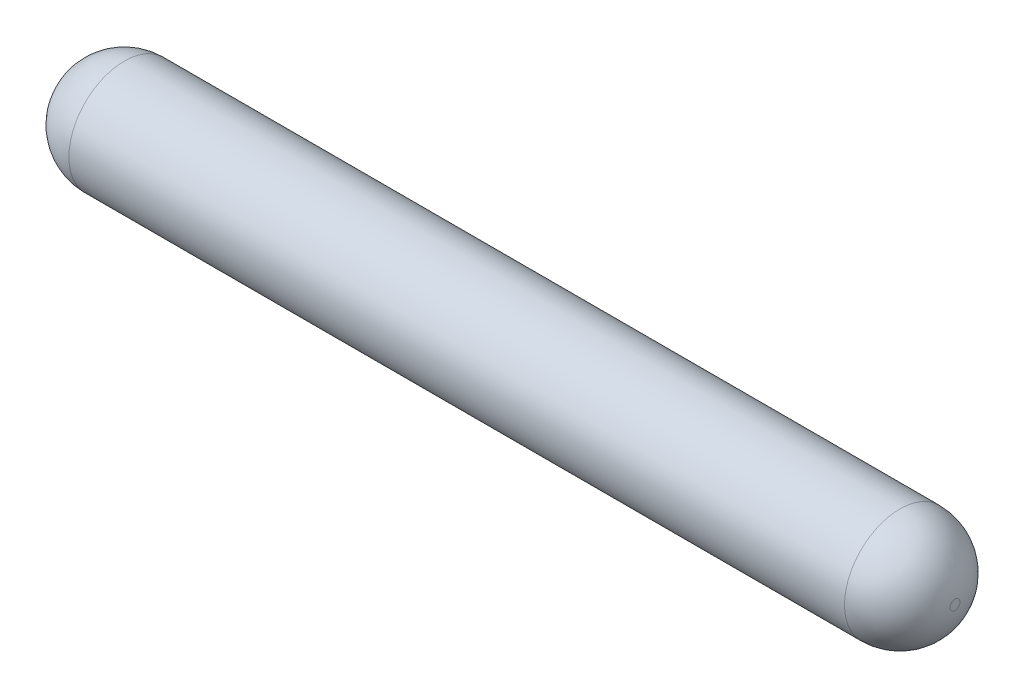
SolidWorks part; units mm, degrees
ref_plane "Front" through (0, 0, 0) normal (0, 0, 1) x (1, 0, 0)
ref_plane "Top" through (0, 0, 0) normal (0, 1, 0) x (1, 0, 0)
ref_plane "Right" through (0, 0, 0) normal (1, 0, 0) x (0, 0, -1)
sketch "Sketch1" plane through (0, 0, 0) normal (0, 1, 0) x (1, 0, 0)
  line L0 (40, 0) -> (40, 0.2234)
  line L1 (0.01, 0) -> (40, 0)
  line L3 (2.5, 2.5) -> (37.51, 2.5)
  line L5 (0.01, 0) -> (0.01, 0.2234)
  arc A0 (2.5, 2.5) -> (0.01, 0.2234) centre (2.5, 0) ccw
  arc A1 (40, 0.2234) -> (37.51, 2.5) centre (37.51, 0) ccw
revolve "Revolve1" add sketch "Sketch1" angle 360 about L1
